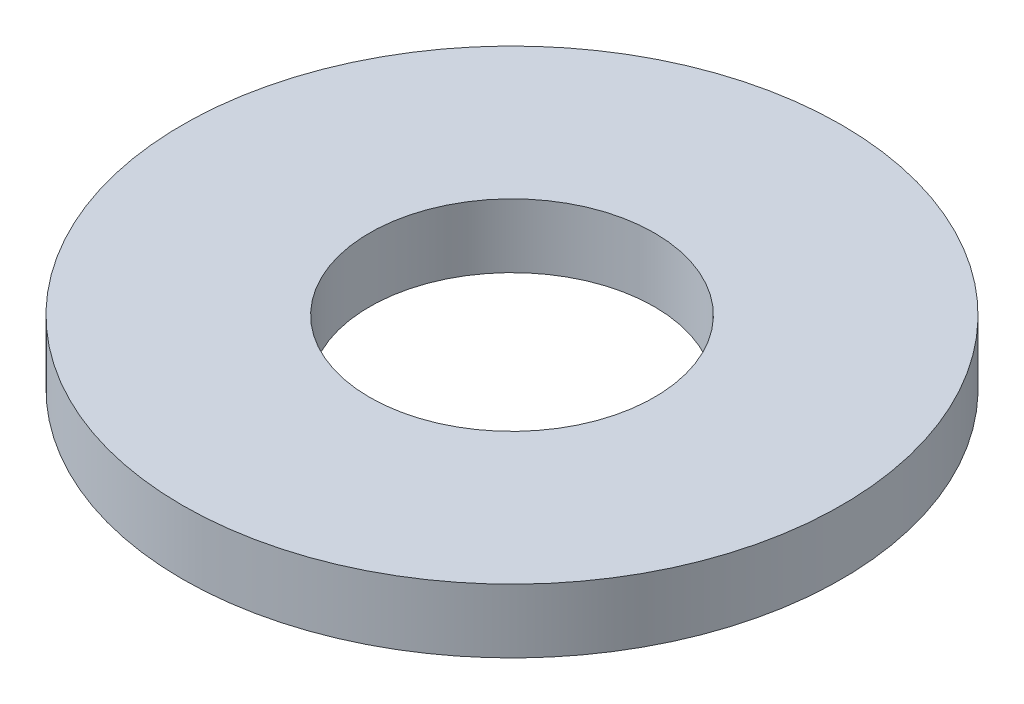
SolidWorks part; units mm, degrees
ref_plane "Front Plane" through (0, 0, 0) normal (0, 0, 1) x (1, 0, 0)
ref_plane "Top Plane" through (0, 0, 0) normal (0, 1, 0) x (1, 0, 0)
ref_plane "Right Plane" through (0, 0, 0) normal (1, 0, 0) x (0, 0, -1)
sketch "Sketch1" plane through (0, 0, 0) normal (0, 1, 0) x (1, 0, 0)
  circle A0 centre (0, 0) radius 4.5847
  circle A1 centre (0, 0) radius 1.9812
  dimension "D1" = 3.9624
  dimension "D2" = 9.1694
extrude "Boss-Extrude1" add sketch "Sketch1" along normal blind 0.889
